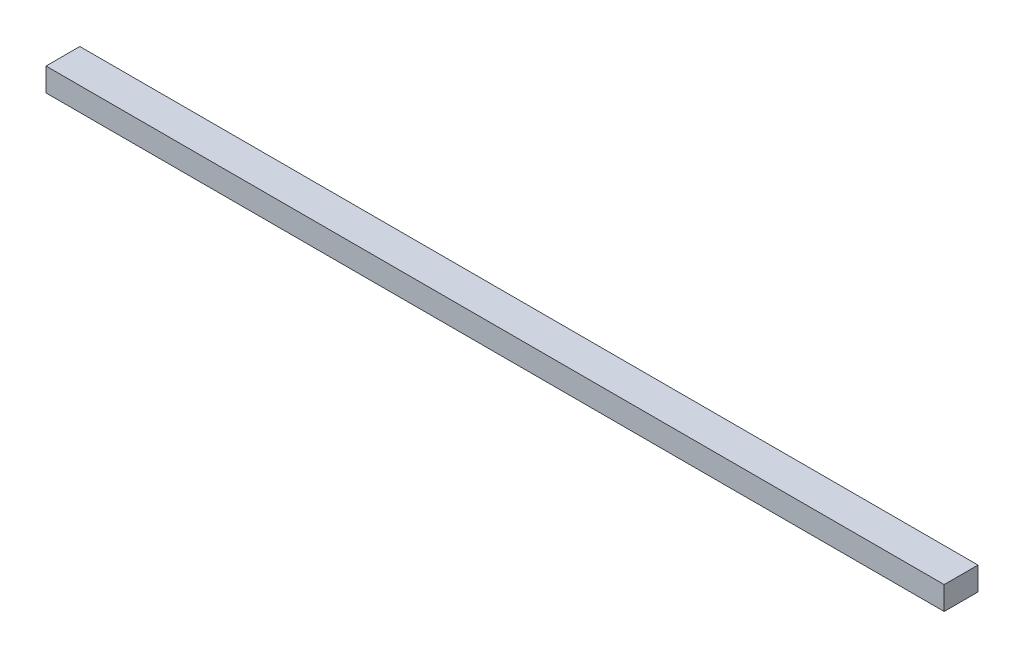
SolidWorks part; units mm, degrees
ref_plane "Front Plane" through (0, 0, 0) normal (0, 0, 1) x (1, 0, 0)
ref_plane "Top Plane" through (0, 0, 0) normal (0, 1, 0) x (1, 0, 0)
ref_plane "Right Plane" through (0, 0, 0) normal (1, 0, 0) x (0, 0, -1)
sketch "Sketch1" plane through (0, 0, 0) normal (0, 1, 0) x (1, 0, 0)
  line L1 (-244.475, -9.2075) -> (244.475, -9.2075)
  line L2 (-244.475, -9.2075) -> (-244.475, 9.2075)
  line L3 (-244.475, 9.2075) -> (244.475, 9.2075)
  line L4 (244.475, -9.2075) -> (244.475, 9.2075)
  line L5 (-244.475, -9.2075) -> (244.475, 9.2075) construction
  line L6 (-244.475, 9.2075) -> (244.475, -9.2075) construction
  point P0 (0, 0)
  dimension "D1" = 18.415
  dimension "D2" = 488.95
extrude "Boss-Extrude1" add sketch "Sketch1" along normal blind 12.7
